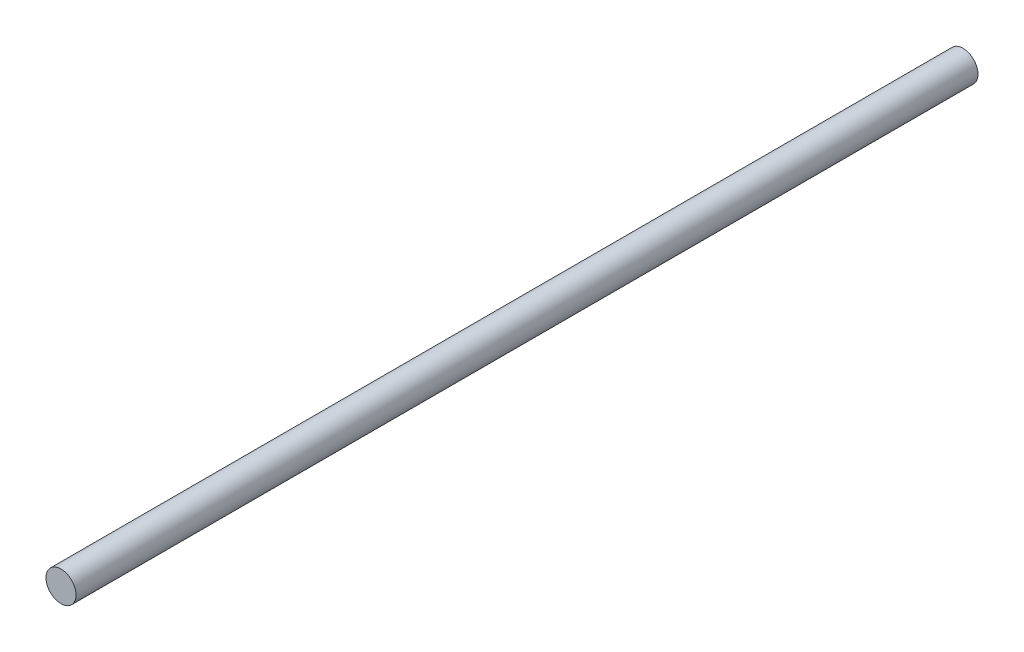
SolidWorks part; units mm, degrees
ref_plane "Front Plane" through (0, 0, 0) normal (0, 0, 1) x (1, 0, 0)
ref_plane "Top Plane" through (0, 0, 0) normal (0, 1, 0) x (1, 0, 0)
ref_plane "Right Plane" through (0, 0, 0) normal (1, 0, 0) x (0, 0, -1)
sketch "Sketch1" plane through (0, 0, 0) normal (0, 0, 1) x (1, 0, 0)
  circle A0 centre (0, 0) radius 30
  dimension "D1" = 60
extrude "Boss-Extrude1" add sketch "Sketch1" against normal blind 1800
